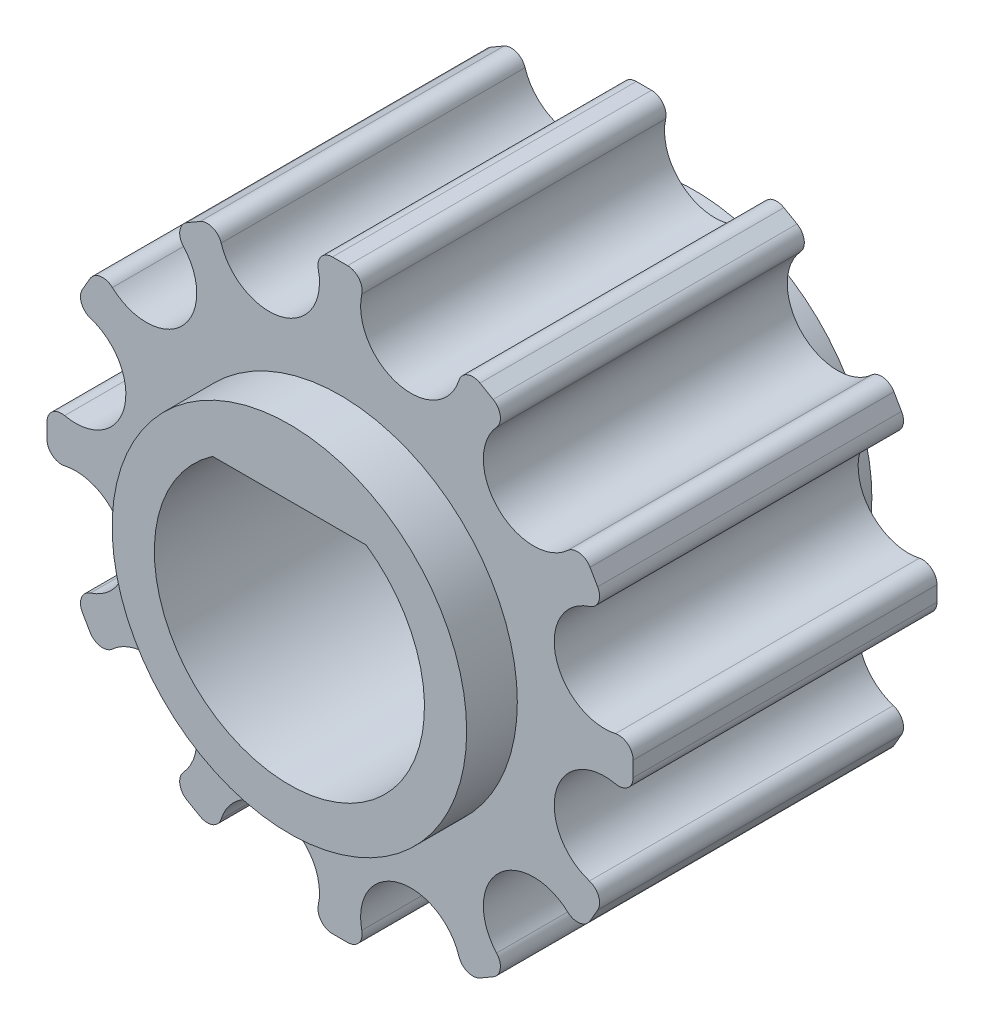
SolidWorks part; units mm, degrees
ref_plane "Front Plane" through (0, 0, 0) normal (0, 0, 1) x (1, 0, 0)
ref_plane "Top Plane" through (0, 0, 0) normal (0, 1, 0) x (1, 0, 0)
ref_plane "Right Plane" through (0, 0, 0) normal (1, 0, 0) x (0, 0, -1)
other "Configuration Table"
sketch "Sketch2" plane through (0, 0, 0) normal (0, 0, 1) x (1, 0, 0)
  circle A0 centre (0, 0) radius 9.5493
extrude "PD" add sketch "Sketch2" along normal mid plane 9
sketch "Sketch3" plane through (0, 0, 4.5) normal (0, 0, 1) x (1, 0, 0)
  line L0 (0, 0) -> (0, 8.6793) construction
  line L1 (0, 0) -> (2.0988, 7.833) construction
  line L2 (0, 8.6793) -> (0.2245, 8.6793)
  line L3 (0, 8.6793) -> (0, 9.5493)
  line L4 (4.3396, 7.5165) -> (4.7746, 8.2699)
  line L5 (4.3396, 7.5165) -> (4.1452, 7.6288)
  line L6 (2.0988, 7.833) -> (2.4715, 9.2239) construction
  arc A0 (0.2245, 8.6793) -> (0.6443, 8.1561) centre (0.2245, 8.2493) cw
  arc A1 (0.6443, 8.1561) -> (3.5201, 7.3855) centre (2.0988, 7.833) ccw
  circle A2 centre (0, 0) radius 9.5493 construction
  arc A3 (0, 9.5493) -> (4.7746, 8.2699) centre (0, 0) cw
  arc A4 (4.1452, 7.6288) -> (3.5201, 7.3855) centre (3.9302, 7.2564) ccw
  point P8 (1.7132, 6.3937)
extrude "Teeth" cut sketch "Sketch3" against normal up to surface (9 mm away)
pattern_circular "CirPattern1" count 12 over 360 about axis through (0, 0, 0) along (0, 0, 1) of "Teeth"
sketch "Sketch4" plane through (0, 0, 4.5) normal (0, 0, 1) x (1, 0, 0)
  circle A0 centre (0, 0) radius 10.5493
extrude "Flange" [suppressed] add sketch "Sketch4" along normal blind 1
mirror "Flange 2" [suppressed] about plane through (0, 0, 0) normal (0, 0, 1)
sketch "Sketch6" plane through (0, 0, 0) normal (0, 0, 1) x (1, 0, 0)
  line L0 (0, -4) -> (0, 3.2898) construction
  line L2 (0, 3.2898) -> (2.2753, 3.2898)
  line L4 (0, 3.2898) -> (-2.2753, 3.2898)
  circle A0 centre (0, 0) radius 4 construction
  circle A1 centre (0, 0) radius 4
  dimension "D2" = 7.2898
  dimension "D1" = 8
extrude "Cut-Extrude2" cut sketch "Sketch6" against normal through all both and the other way through all contours L4 A1 L2
sketch "Sketch8" plane through (0, 0, 4.5) normal (0, 0, 1) x (1, 0, 0)
  line L0 (-2.2753, 3.2898) -> (2.2753, 3.2898)
  line L1 (2.2753, 3.2898) -> (-2.2753, 3.2898) construction
  circle A0 centre (0, 0) radius 5.25
  arc A1 (-2.2753, 3.2898) -> (2.2753, 3.2898) centre (0, 0) ccw construction
  arc A2 (2.2753, 3.2898) -> (-2.2753, 3.2898) centre (0, 0) cw
  dimension "D1" = 10.5
extrude "Boss-Extrude2" add sketch "Sketch8" along normal blind 1.5
sketch "Sketch9" plane through (0, 0, -4.5) normal (0, 0, -1) x (-1, 0, 0)
  line L0 (-2.2753, 3.2898) -> (2.2753, 3.2898)
  arc A0 (2.2753, 3.2898) -> (-2.2753, 3.2898) centre (0, 0) cw
  arc A1 (-2.2753, 3.2898) -> (2.2753, 3.2898) centre (0, 0) ccw construction
  circle A2 centre (0, 0) radius 5.25
  circle A3 centre (0, 0) radius 12.7 construction
  dimension "D1" = 10.5
  dimension "D2" = 25.4
extrude "Boss-Extrude3" add sketch "Sketch9" along normal blind 1.5
sketch "Sketch7" [suppressed] plane through (0, 0, -5.5) normal (0, 0, -1) x (-1, 0, 0)
  line L0 (3.6662, 6.35) -> (7.3323, 0) construction
  line L1 (7.3323, 0) -> (3.6662, -6.35) construction
  line L2 (3.6662, -6.35) -> (-3.6662, -6.35) construction
  line L3 (-3.6662, -6.35) -> (-7.3323, 0) construction
  line L4 (-7.3323, 0) -> (-3.6662, 6.35) construction
  line L5 (-3.6662, 6.35) -> (3.6662, 6.35) construction
  line L6 (3.6662, 6.35) -> (7.3323, 0)
  line L7 (7.3323, 0) -> (3.6662, -6.35)
  line L8 (3.6662, -6.35) -> (-3.6662, -6.35)
  line L9 (-3.6662, -6.35) -> (-7.3323, 0)
  line L10 (-7.3323, 0) -> (-3.6662, 6.35)
  line L11 (-3.6662, 6.35) -> (3.6662, 6.35)
  circle A0 centre (0, 0) radius 4
  circle A1 centre (0, 0) radius 10.5493
  circle A2 centre (0, 0) radius 10.5493
  dimension "D1" = 0
extrude "Boss-Extrude1" [suppressed] add sketch "Sketch7" against normal up to surface (11 mm away)
equation "\"D1@Sketch4\"= 16 + 2"
equation "\"D1@CirPattern1\" = 16"
equation "\"D4@Sketch3\" = 180 / 16"
equation "\"D1@Sketch2\" = 16 * 5 / pi"
